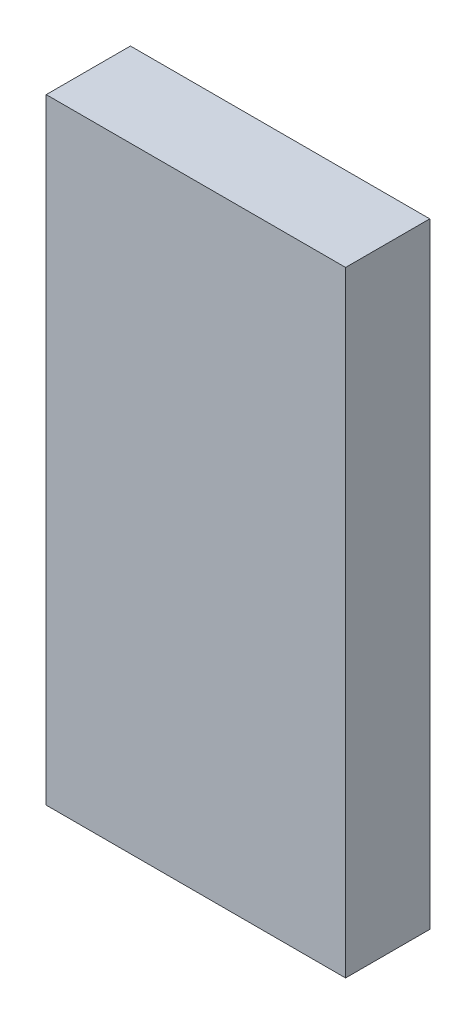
SolidWorks part; units mm, degrees
ref_plane "Plan de face" through (0, 0, 0) normal (1, 0, 0) x (0, 1, 0)
ref_plane "Plan de dessus" through (0, 0, 0) normal (0, 0, 1) x (0, 1, 0)
ref_plane "Plan de droite" through (0, 0, 0) normal (0, 1, 0) x (-1, 0, 0)
sketch "Esquisse1" plane through (0, 0, 0) normal (0, 0, 1) x (0, 1, 0)
  spline S0 degree 3 poles (80.0146, 184.2691) (79.7356, 184.7996) (79.1109, 184.5209) (78.6433, 184.6715) knots 0 0 0 0 1 1 1 1
  spline S1 degree 3 poles (78.6433, 184.6715) (76.6142, 184.9757) (74.5088, 186.2415) (73.9716, 188.3207) knots 0 0 0 0 1 1 1 1
  spline S2 degree 3 poles (73.9716, 188.3207) (73.5433, 189.9244) (74.7012, 191.4922) (76.0807, 192.2102) knots 0 0 0 0 1 1 1 1
  spline S3 degree 3 poles (76.6534, 204.1492) (76.6112, 204.5692) (76.6187, 204.9939) (76.6755, 205.4126) knots 0 0 0 0 1 1 1 1
  spline S4 degree 3 poles (76.6755, 205.4126) (76.7018, 206.5315) (77.5721, 207.4167) (78.6082, 207.7278) knots 0 0 0 0 1 1 1 1
  spline S5 degree 3 poles (79.6016, 209.3338) (79.4871, 209.9771) (79.5574, 210.6541) (79.8205, 211.252) knots 0 0 0 0 1 1 1 1
  spline S6 degree 3 poles (79.4482, 212.8923) (79.2153, 213.0932) (78.9656, 213.2781) (78.733, 213.4588) knots 0 0 0 0 1 1 1 1
  spline S7 degree 3 poles (78.733, 213.4588) (78.0696, 213.839) (77.5483, 214.475) (77.4712, 215.2525) knots 0 0 0 0 1 1 1 1
  spline S8 degree 3 poles (82.2379, 224.0104) (83.1711, 224.4788) (84.1621, 224.9864) (85.2306, 224.9928) knots 0 0 0 0 1 1 1 1
  spline S9 degree 3 poles (85.2306, 224.9928) (86.4396, 224.6031) (87.3122, 223.5165) (88.5347, 223.1211) knots 0 0 0 0 1 1 1 1
  spline S10 degree 3 poles (88.5347, 223.1211) (88.9788, 222.9202) (89.5419, 222.8947) (89.8604, 223.3321) knots 0 0 0 0 1 1 1 1
  spline S11 degree 3 poles (89.8604, 223.3321) (90.1694, 223.8977) (90.8739, 223.954) (91.324, 224.3344) knots 0 0 0 0 1 1 1 1
  spline S12 degree 3 poles (91.324, 224.3344) (91.6886, 225.4843) (92.6617, 226.5488) (93.9272, 226.6501) knots 0 0 0 0 1 1 1 1
  spline S13 degree 3 poles (93.9272, 226.6501) (94.4376, 226.5253) (94.7678, 227.0265) (95.2328, 227.1315) knots 0 0 0 0 1 1 1 1
  spline S14 degree 3 poles (111.581, 218.4742) (112.6296, 217.8357) (113.9089, 218.3342) (114.9574, 218.7161) knots 0 0 0 0 1 1 1 1
  spline S15 degree 3 poles (114.9574, 218.7161) (117.4442, 219.7968) (120.1511, 220.8572) (122.9154, 220.3967) knots 0 0 0 0 1 1 1 1
  spline S16 degree 3 poles (122.9154, 220.3967) (126.4496, 219.6978) (129.3459, 217.1268) (131.0602, 214.0458) knots 0 0 0 0 1 1 1 1
  spline S17 degree 3 poles (133.0703, 204.4452) (133.0973, 202.8479) (132.0246, 201.5368) (130.9703, 200.4472) knots 0 0 0 0 1 1 1 1
  spline S18 degree 3 poles (130.9703, 200.4472) (129.2937, 198.4158) (129.0361, 195.7627) (128.1888, 193.36) knots 0 0 0 0 1 1 1 1
  spline S19 degree 3 poles (128.1888, 193.36) (127.8976, 192.2997) (127.2525, 191.4038) (126.7748, 190.429) knots 0 0 0 0 1 1 1 1
  spline S20 degree 3 poles (126.7748, 190.429) (126.3801, 189.0089) (126.6808, 187.5829) (127.1374, 186.2148) knots 0 0 0 0 1 1 1 1
  spline S21 degree 3 poles (127.1374, 186.2148) (127.6097, 184.951) (128.0893, 183.7059) (128.8065, 182.5828) knots 0 0 0 0 1 1 1 1
  spline S22 degree 3 poles (128.8065, 182.5828) (130.5039, 181.3307) (131.4926, 179.0641) (130.9645, 176.9909) knots 0 0 0 0 1 1 1 1
  spline S23 degree 3 poles (130.9645, 176.9909) (130.5816, 174.9982) (128.418, 173.7473) (126.4666, 174.0167) knots 0 0 0 0 1 1 1 1
  spline S24 degree 3 poles (96.0846, 171.9019) (94.0343, 171.5517) (92.2536, 170.4742) (90.4278, 169.5722) knots 0 0 0 0 1 1 1 1
  spline S25 degree 3 poles (90.4278, 169.5722) (88.7018, 168.6355) (86.6578, 168.0082) (84.6977, 168.5255) knots 0 0 0 0 1 1 1 1
  spline S26 degree 3 poles (84.6977, 168.5255) (84.0959, 168.7396) (83.3687, 168.898) (82.9813, 169.4439) knots 0 0 0 0 1 1 1 1
  spline S27 degree 3 poles (82.9813, 169.4439) (82.3657, 170.7175) (82.309, 172.2128) (82.5466, 173.5915) knots 0 0 0 0 1 1 1 1
  spline S28 degree 3 poles (82.5466, 173.5915) (82.9044, 175.8865) (84.4384, 177.9316) (84.2471, 180.3152) knots 0 0 0 0 1 1 1 1
  spline S29 degree 3 poles (84.2471, 180.3152) (82.8962, 181.6958) (81.3597, 182.8829) (80.0146, 184.2691) knots 0 0 0 0 1 1 1 1
  spline S30 degree 3 poles (100.9705, 224.4748) (101.2078, 224.5429) (101.451, 224.591) (101.6973, 224.6161) knots 0 0 0 0 1 1 1 1
  spline S31 degree 3 poles (77.8692, 200.0153) (78.5924, 201.016) (78.1945, 202.4502) (77.236, 203.1412) knots 0 0 0 0 1 1 1 1
  spline S32 degree 3 poles (131.3616, 210.948) (131.9619, 208.8116) (133.2135, 206.7566) (133.0703, 204.4452) knots 0 0 0 0 1 1 1 1
  spline S33 degree 3 poles (131.2156, 213.1055) (131.0849, 212.3903) (131.1579, 211.6448) (131.3616, 210.948) knots 0 0 0 0 1 1 1 1
  spline S34 degree 3 poles (76.0807, 192.2102) (76.0599, 193.738) (75.1049, 195.0581) (74.9563, 196.5651) knots 0 0 0 0 1 1 1 1
  spline S35 degree 3 poles (109.0852, 221.515) (110.0184, 220.5822) (110.436, 219.1976) (111.581, 218.4742) knots 0 0 0 0 1 1 1 1
  spline S36 degree 3 poles (101.6973, 224.6161) (104.5026, 225.0146) (107.2552, 223.5467) (109.0852, 221.515) knots 0 0 0 0 1 1 1 1
  spline S37 degree 3 poles (76.496, 199.4298) (76.9171, 199.7319) (77.6179, 199.4875) (77.8692, 200.0153) knots 0 0 0 0 1 1 1 1
  spline S38 degree 3 poles (77.4712, 215.2525) (77.0404, 218.7867) (79.1853, 222.2939) (82.2379, 224.0104) knots 0 0 0 0 1 1 1 1
  spline S39 degree 3 poles (74.9563, 196.5651) (74.7055, 197.7393) (75.4049, 198.9589) (76.496, 199.4298) knots 0 0 0 0 1 1 1 1
  spline S40 degree 3 poles (95.2328, 227.1315) (95.8616, 227.0952) (96.3792, 227.5058) (96.9668, 227.6429) knots 0 0 0 0 1 1 1 1
  spline S41 degree 3 poles (97.3993, 227.5472) (97.8419, 227.0299) (98.1323, 226.4344) (98.3559, 225.808) knots 0 0 0 0 1 1 1 1
  spline S42 degree 3 poles (96.9668, 227.6429) (97.1193, 227.6581) (97.2639, 227.613) (97.3993, 227.5472) knots 0 0 0 0 1 1 1 1
  spline S43 degree 3 poles (126.4666, 174.0167) (122.1277, 174.8405) (117.7292, 175.4498) (113.3172, 174.9511) knots 0 0 0 0 1 1 1 1
  spline S44 degree 3 poles (100.2119, 173.3273) (98.7776, 173.0252) (97.4624, 172.3724) (96.0846, 171.9019) knots 0 0 0 0 1 1 1 1
  spline S45 degree 3 poles (113.3172, 174.9511) (108.9531, 174.2831) (104.5077, 174.3977) (100.2119, 173.3273) knots 0 0 0 0 1 1 1 1
  spline S46 degree 3 poles (79.8205, 211.252) (80.0708, 211.8208) (79.92, 212.4853) (79.4482, 212.8923) knots 0 0 0 0 1 1 1 1
  spline S47 degree 3 poles (78.6082, 207.7278) (79.301, 207.9358) (79.7278, 208.6257) (79.6016, 209.3338) knots 0 0 0 0 1 1 1 1
  spline S48 degree 3 poles (98.3559, 225.808) (98.7351, 224.7463) (99.8812, 224.1618) (100.9705, 224.4748) knots 0 0 0 0 1 1 1 1
  spline S49 degree 3 poles (76.6534, 204.1492) (76.6938, 203.746) (76.9059, 203.3791) (77.236, 203.1412) knots 0 0 0 0 1 1 1 1
  spline S50 degree 3 poles (131.2156, 213.1055) (131.2744, 213.4274) (131.2195, 213.7595) (131.0602, 214.0458) knots 0 0 0 0 1 1 1 1
extrude "Boss.-Extru.1" add sketch "Esquisse1" along normal blind 6
sketch "Esquisse2" plane through (0, 0, 6) normal (0, 0, 1) x (0, -1, 0)
  line L0 (-67.1716, -232.4429) -> (-67.1716, -163.7255)
  line L1 (-65.9716, -233.6429) -> (-139.0703, -233.6429)
  line L2 (-65.9716, -233.6429) -> (-65.9716, -162.5255)
  line L3 (-65.9716, -162.5255) -> (-139.0703, -162.5255)
  line L4 (-139.0703, -233.6429) -> (-139.0703, -162.5255)
  line L5 (-65.9716, -233.6429) -> (-139.0703, -162.5255) construction
  line L6 (-65.9716, -162.5255) -> (-139.0703, -233.6429) construction
  line L7 (-67.1716, -163.7255) -> (-137.8703, -163.7255)
  line L8 (-137.8703, -232.4429) -> (-137.8703, -163.7255)
  line L9 (-67.1716, -232.4429) -> (-137.8703, -232.4429)
  point P0 (-102.5209, -198.0842)
  dimension "D1" = 6
  dimension "D2" = 6
  dimension "D3" = 6
  dimension "D4" = 8
  dimension "D5" = 71.1173
  dimension "D6" = 73.0987
  dimension "D7" = 1.2
extrude "Boss.-Extru.2" add sketch "Esquisse2" against normal blind 10 separate body
sketch "Esquisse3" plane through (0, 0, 6) normal (0, 0, 1) x (0, -1, 0)
  line L1 (-139.0703, -233.6429) -> (-65.9716, -233.6429)
  line L2 (-139.0703, -233.6429) -> (-139.0703, -162.5255)
  line L3 (-139.0703, -162.5255) -> (-65.9716, -162.5255)
  line L4 (-65.9716, -233.6429) -> (-65.9716, -162.5255)
extrude "Boss.-Extru.3" add sketch "Esquisse3" along normal blind 2
sketch "Esquisse4" plane through (0, 0, 6) normal (0, 0, -1) x (0, 1, 0)
  line L0 (139.0703, -198.0842) -> (147.9545, -198.0842) construction
  line L1 (139.0703, -162.5255) -> (139.0703, -233.6429) construction
  line L2 (139.0703, -233.6429) -> (65.9716, -233.6429) construction
  line L4 (102.5209, -162.5255) -> (102.5209, -155.1574) construction
  line L5 (65.9716, -162.5255) -> (139.0703, -162.5255) construction
  circle A0 centre (133.0703, -227.6429) radius 3
  circle A1 centre (133.0703, -168.5255) radius 3
  circle A2 centre (71.9716, -168.5255) radius 3
  circle A3 centre (71.9716, -227.6429) radius 3
  dimension "D1" = 6
  dimension "D2" = 6
  dimension "D3" = 6
extrude "Boss.-Extru.4" add sketch "Esquisse4" along normal blind 8
ref_plane "Plan2" through (0, 65.9716, 0) normal (0, -1, 0) x (1, 0, 0)
mirror "Symétrie1" about plane through (0, 65.9716, 0) normal (0, -1, 0)
sketch "Esquisse6" plane through (-162.5255, 0, 0) normal (1, 0, 0) x (0, 1, 0)
  line L1 (-7.127, 8) -> (139.0703, 8)
  line L2 (-7.127, 8) -> (-7.127, 16)
  line L3 (-7.127, 16) -> (139.0703, 16)
  line L4 (139.0703, 8) -> (139.0703, 16)
  point P5 (139.0703, 8)
  dimension "D1" = 8
extrude "Boss.-Extru.5" add sketch "Esquisse6" against normal up to surface (71.1173 mm away)
sketch "Esquisse7" plane through (0, 0, -2) normal (0, 0, -1) x (0, 1, 0)
  circle A0 centre (59.9716, -227.6429) radius 3.2
  circle A1 centre (59.9716, -168.5255) radius 3.2
  circle A2 centre (-1.127, -168.5255) radius 3.2
  circle A3 centre (-1.127, -227.6429) radius 3.2
extrude "Enlèv. mat.-Extru.1" cut sketch "Esquisse7" against normal blind 16.04
sketch "Esquisse8" plane through (0, 0, 0) normal (0, 0, -1) x (1, 0, 0)
  line L0 (-195.068, -81.0428) -> (-195.068, -125.6527) construction
  text T0 "<b>F A B 2 6 </b>" font "Century Gothic" height 7
  point P3 (-195.068, -79.6941)
  point P4 (-195.068, -125.6527)
  point P5 (-195.068, -81.0428)
extrude "Enlèv. mat.-Extru.2" cut sketch "Esquisse8" against normal blind 4
sketch "Esquisse9" plane through (0, 0, 0) normal (0, 0, -1) x (0, 1, 0)
  line L0 (9.9039, -195.6236) -> (49.6426, -194.5547) construction
  text T0 "<b>F A B 2 6</b>" font "Century Gothic" height 7
  point P5 (8.9814, -198.3451)
  point P6 (53.2023, -196.626)
  point P7 (5.7445, -198.4248)
  point P8 (49.6426, -194.5547)
  point P9 (9.9039, -195.6236)
extrude "Enlèv. mat.-Extru.3" cut sketch "Esquisse9" against normal blind 4
fillet "Congé1" radius 3 4 edges at (-165.5255, 133.0703, 6) (-171.5255, 71.9716, 6) (-224.6429, 71.9716, 6) (-230.6429, 133.0703, 6)
fillet "Congé2" radius 2 4 edges at (-171.7255, 59.9716, 6) (-171.7255, -1.127, 6) (-230.8429, -1.127, 6) (-230.8429, 59.9716, 6)
equation "\"D2@Esquisse7\"=\"D1@Esquisse7\""
equation "\"D3@Esquisse7\"=\"D1@Esquisse7\""
equation "\"D4@Esquisse7\"=\"D3@Esquisse7\""
